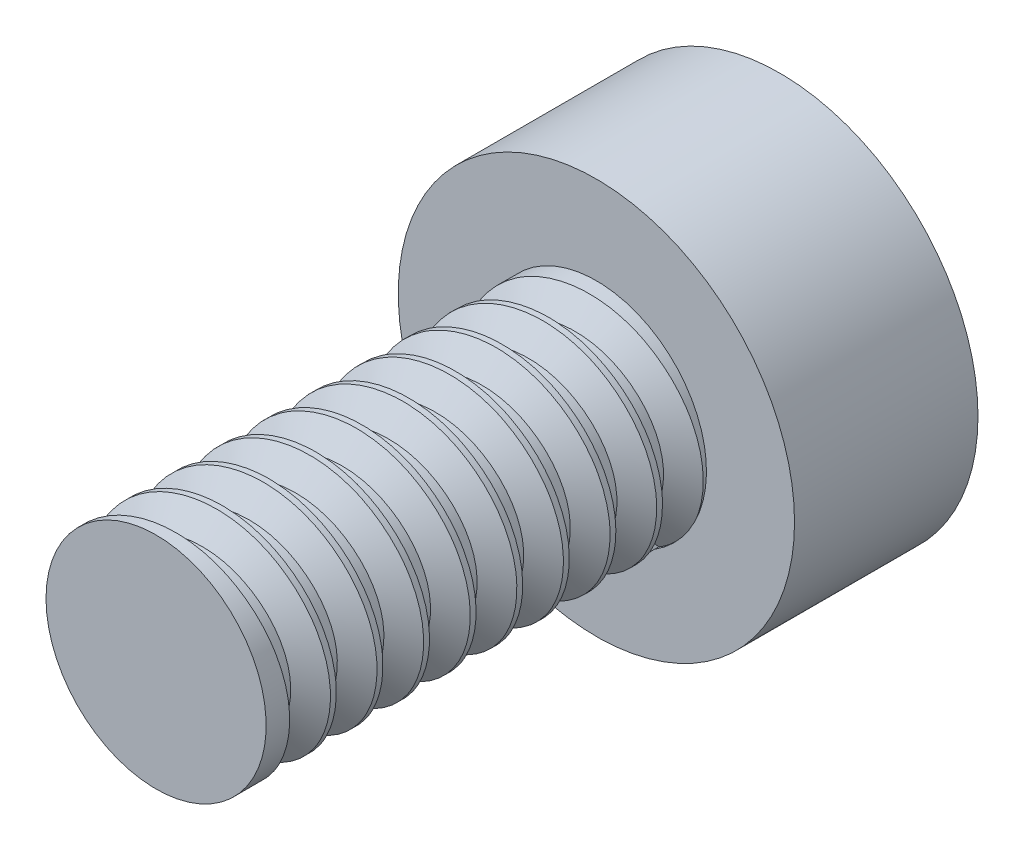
SolidWorks part; units mm, degrees
ref_plane "前视基准面" through (0, 0, 0) normal (0, 0, 1) x (1, 0, 0)
ref_plane "上视基准面" through (0, 0, 0) normal (0, 1, 0) x (1, 0, 0)
ref_plane "右视基准面" through (0, 0, 0) normal (1, 0, 0) x (0, 0, -1)
sketch "草图1" plane through (0, 0, 0) normal (0, 0, 1) x (1, 0, 0)
  circle A0 centre (0, 0) radius 2.7
  dimension "D1" = 5.4
extrude "凸台-拉伸1" add sketch "草图1" along normal blind 2.5
sketch "草图2" plane through (0, 0, 2.5) normal (0, 0, 1) x (1, 0, 0)
  circle A0 centre (0, 0) radius 1.5
  dimension "D1" = 3
extrude "凸台-拉伸2" add sketch "草图2" along normal blind 6
thread "螺纹线1" pitch 0.635 start angle 0, offset 0, length 5.5, pitch 0.635, diameter 3
ref_plane "基准面4" through (-1.5, 0, 8.5) normal (0, -1, 0) x (-1, 0, 0)
sketch "螺纹线轮廓1" plane through (-1.5, 0, 8.5) normal (0, -1, 0) x (-1, 0, 0)
  line L0 (0, 0) -> (0, 0.635) construction
  line L11 (0, 0) -> (0, 0.5556)
  line L12 (0, 0.5556) -> (-0.3437, 0.3572)
  line L13 (-0.3437, 0.3572) -> (-0.3437, 0.1984)
  line L15 (-0.3437, 0.1984) -> (0, 0)
  line L17 (-0.3437, 0.2778) -> (0, 0.2778) construction
  point P2 (0, 0)
  dimension "Pitch" = 0.635
  dimension "Profile_Angle" = 60
  dimension "Profile_Land" = 0.1588
  dimension "Profile_Height" = 0.3437
sketch "草图6" plane through (0, 0, 0) normal (0, 0, -1) x (-1, 0, 0)
  line L1 (1.5433, -0.7863) -> (1.4526, 0.9434)
  line L2 (1.4526, 0.9434) -> (-0.0907, 1.7297)
  line L3 (-0.0907, 1.7297) -> (-1.5433, 0.7863)
  line L4 (-1.5433, 0.7863) -> (-1.4526, -0.9434)
  line L5 (-1.4526, -0.9434) -> (0.0907, -1.7297)
  line L6 (0.0907, -1.7297) -> (1.5433, -0.7863)
  circle A0 centre (0, 0) radius 1.5 construction
  dimension "D1" = 3
extrude "切除-拉伸1" cut sketch "草图6" against normal blind 0.5
